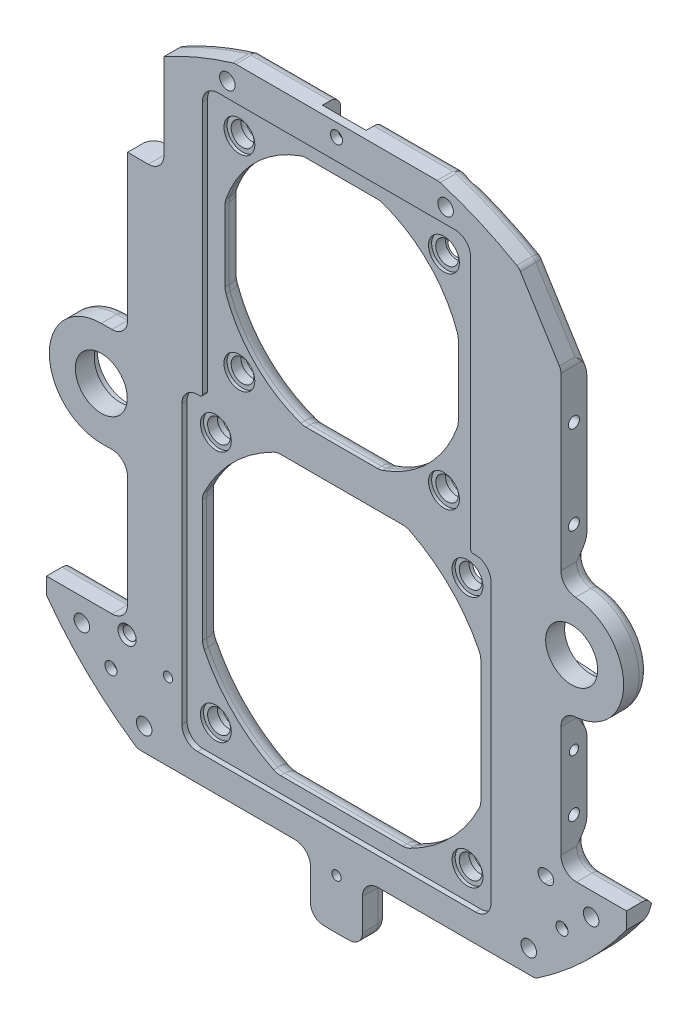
SolidWorks part; units mm, degrees
ref_plane "Front Plane" through (0, 0, 0) normal (0, 0, 1) x (1, 0, 0)
ref_plane "Top Plane" through (0, 0, 0) normal (0, 1, 0) x (1, 0, 0)
ref_plane "Right Plane" through (0, 0, 0) normal (1, 0, 0) x (0, 0, -1)
sketch "Sketch1" plane through (0, 0, 0) normal (0, 0, 1) x (1, 0, 0)
  line L2 (-51.054, 52.1208) -> (-45.974, 52.1208)
  line L3 (-42.164, 55.9308) -> (-42.164, 76.8194)
  line L4 (87.63, 0) -> (-87.63, 0) construction
  line L5 (0, 87.63) -> (0, -87.63) construction
  line L11 (-51.054, -43.6754) -> (-51.054, -16.51)
  line L12 (-51.054, 16.51) -> (-51.054, 52.1208)
  line L14 (54.4653, 59.6481) -> (44.9354, 74.8991)
  line L15 (6.35, -76.708) -> (6.35, -84.3953)
  line L17 (-6.35, -76.708) -> (-6.35, -84.3953)
  line L18 (54.8513, -16.5185) -> (54.8513, -43.6754)
  line L21 (47.8532, -72.898) -> (10.16, -72.898)
  line L22 (70.866, -47.4854) -> (58.6613, -47.4854)
  line L23 (54.8513, 16.5185) -> (54.8513, 58.3021)
  line L25 (-54.864, -12.7) -> (-57.4802, -12.7)
  line L26 (-54.864, 12.7) -> (-57.4802, 12.7)
  line L28 (-54.864, -47.4854) -> (-70.866, -47.4854)
  line L30 (24.6055, 83.9947) -> (-24.6055, 83.9947)
  line L31 (-10.16, -72.898) -> (-47.8532, -72.898)
  line L32 (70.866, -47.4854) -> (70.866, -51.5451)
  line L33 (-70.866, -47.4854) -> (-70.866, -51.5451)
  arc A1 (-45.974, 52.1208) -> (-42.164, 55.9308) centre (-45.974, 55.9308) ccw
  arc A3 (58.4276, -12.6646) -> (58.4276, 12.6646) centre (57.4802, 0) ccw
  arc A4 (-57.4802, 12.7) -> (-57.4802, -12.7) centre (-57.4802, 0) ccw
  arc A7 (70.866, -51.5451) -> (49.2817, -72.4583) centre (0, 0) cw
  arc A8 (44.0584, 75.7487) -> (25.34, 83.8862) centre (0, 0) ccw
  arc A10 (-51.054, 16.51) -> (-54.864, 12.7) centre (-54.864, 16.51) cw
  arc A11 (-51.054, -16.51) -> (-54.864, -12.7) centre (-54.864, -16.51) ccw
  arc A14 (-49.2817, -72.4583) -> (-70.866, -51.5451) centre (0, 0) cw
  arc A15 (-51.054, -43.6754) -> (-54.864, -47.4854) centre (-54.864, -43.6754) cw
  arc A16 (54.8513, -43.6754) -> (58.6613, -47.4854) centre (58.6613, -43.6754) ccw
  arc A18 (54.8513, 16.5185) -> (58.4276, 12.6646) centre (58.7159, 16.5185) ccw
  arc A19 (54.8513, -16.5185) -> (58.4276, -12.6646) centre (58.7159, -16.5185) cw
  arc A20 (-25.34, 83.8862) -> (-42.164, 76.8194) centre (0, 0) ccw
  arc A22 (3.2944, -87.5681) -> (-3.2944, -87.5681) centre (0, 0) cw
  arc A23 (6.35, -76.708) -> (10.16, -72.898) centre (10.16, -76.708) cw
  arc A24 (-10.16, -72.898) -> (-6.35, -76.708) centre (-10.16, -76.708) cw
  arc A25 (6.35, -84.3953) -> (3.2944, -87.5681) centre (3.175, -84.3953) cw
  arc A26 (-6.35, -84.3953) -> (-3.2944, -87.5681) centre (-3.175, -84.3953) ccw
  arc A27 (-47.8532, -72.898) -> (-49.2817, -72.4583) centre (-47.8532, -70.358) cw
  arc A28 (47.8532, -72.898) -> (49.2817, -72.4583) centre (47.8532, -70.358) ccw
  arc A29 (-25.34, 83.8862) -> (-24.6055, 83.9947) centre (-24.6055, 81.4547) cw
  arc A30 (25.34, 83.8862) -> (24.6055, 83.9947) centre (24.6055, 81.4547) ccw
  arc A31 (44.9354, 74.8991) -> (44.0584, 75.7487) centre (42.7814, 73.5531) ccw
  arc A32 (54.4653, 59.6481) -> (54.8513, 58.3021) centre (52.3113, 58.3021) cw
  point P11 (-70.866, -49.5153)
  point P37 (-51.054, -47.4854)
  point P40 (54.8513, -47.4854)
  point P47 (6.35, -72.898)
  point P51 (-6.35, -72.898)
  point P67 (-51.054, 12.7)
  point P70 (-51.054, -12.7)
  point P72 (54.8513, 59.0304)
  dimension "D1" = 42.164
  dimension "D3" = 3.81
  dimension "D5" = 87.63
  dimension "D7" = 54.8513
  dimension "D9" = 87.6293
  dimension "D10" = 12.7
  dimension "D11" = 12.7
  dimension "D4" = 3.81
  dimension "D16" = 3.81
  dimension "D19" = 3.8646
  dimension "D17" = 87.63
  dimension "D21" = 87.63
  dimension "D22" = 3.81
  dimension "D23" = 3.175
  dimension "D25" = 2.54
  dimension "D2" = 52.1208
  dimension "D6" = 83.9947
  dimension "D8" = 72.898
  dimension "D12" = 212
  dimension "D13" = 59.0304
  dimension "D14" = 51.054
  dimension "D15" = 47.4854
  dimension "D18" = 57.4802
  dimension "D20" = 6.35
  dimension "D24" = 10.16
  dimension "D26" = 70.866
extrude "Boss-Extrude1" add sketch "Sketch1" along normal blind 6.35
hole_wizard "1/2 (0.5) Diameter Hole1" positions "Sketch8" profile "Sketch9" hole size "1/2" standard "ANSI Inch"
sketch "Sketch8" plane through (0, 0, 6.35) normal (0, 0, 1) x (1, 0, 0)
  line L0 (0, 0) -> (80.7636, 0) construction
  line L2 (0, 0) -> (0, 45.4326) construction
  line L4 (0, 0) -> (-84.3163, 0) construction
  point P0 (-57.4802, 0)
  point P3 (57.4802, 0)
  dimension "D1" = 57.4802
  dimension "D2" = 57.4802
sketch "Sketch9" plane through (-57.4802, 0, 6.35) normal (1, 0, 0) x (0, -1, 0)
  line L0 (0, 0) -> (0, 6.35)
  line L1 (0, 6.35) -> (6.35, 6.35)
  line L2 (6.35, 6.35) -> (6.35, 0)
  line L5 (6.35, 0) -> (0, 0)
  line L11 (0, -6.35) -> (0, 107.95) construction
  dimension "Thru Hole Dia." = 12.7
  dimension "Thru Hole Depth" = 6.35
hole_wizard "#4-40 Tapped Hole1" positions "Sketch11" profile "Sketch12" tap size "#4-40" standard "ANSI Inch"
sketch "Sketch11" plane through (54.8513, 0, 0) normal (1, 0, 0) x (0, 0, -1)
  line L0 (0, 0) -> (0, -92.8923) construction
  line L2 (0, 0) -> (53.8464, 0) construction
  point P0 (-3.175, -23.0347)
  dimension "D1" = 3.175
  dimension "D2" = 23.0347
sketch "Sketch12" plane through (54.8513, -23.0347, 3.175) normal (0, 1, 0) x (0, 0, -1)
  line L0 (0, 0) -> (0, 8.2738)
  line L1 (0, 8.2738) -> (1.1303, 7.5946)
  line L2 (1.1303, 7.5946) -> (1.1303, 0)
  line L5 (1.1303, 0) -> (0, 0)
  line L10 (0, 8.2738) -> (-1.1303, 7.5946) construction
  line L11 (0, -6.35) -> (0, 107.95) construction
  dimension "Tap Drill Dia." = 2.2606
  dimension "Tap Drill Depth" = 7.5946
  dimension "Drill Angle" = 118
hole_wizard "#6-32 Tapped Hole1" positions "Sketch13" profile "Sketch14" tap size "#6-32" standard "ANSI Inch"
sketch "Sketch13" plane through (54.8513, 0, 0) normal (1, 0, 0) x (0, 0, -1)
  line L0 (-3.175, 46.3304) -> (-3.175, -36.7157) construction
  line L2 (-30.0077, 0) -> (44.6628, 0) construction
  point P0 (-3.175, 46.3304)
  point P3 (-3.175, 24.765)
  point P6 (-3.175, -36.7157)
  dimension "D1" = 3.175
  dimension "D2" = 24.765
  dimension "D3" = 46.3304
  dimension "D4" = 36.7157
sketch "Sketch14" plane through (54.8513, 46.3304, 3.175) normal (0, 1, 0) x (0, 0, -1)
  line L0 (0, 0) -> (0, 10.2107)
  line L1 (0, 10.2107) -> (1.3525, 9.398)
  line L2 (1.3525, 9.398) -> (1.3525, 0)
  line L5 (1.3525, 0) -> (0, 0)
  line L10 (0, 10.2107) -> (-1.3525, 9.398) construction
  line L11 (0, -6.35) -> (0, 107.95) construction
  dimension "Tap Drill Dia." = 2.7051
  dimension "Tap Drill Depth" = 9.398
  dimension "Drill Angle" = 118
hole_wizard "#6-32 Tapped Hole2" positions "Sketch15" profile "Sketch16" tap size "#6-32" standard "ANSI Inch"
sketch "Sketch15" plane through (-42.164, 0, 0) normal (-1, 0, 0) x (0, 0, 1)
  point P0 (3.1755, 70.1627)
sketch "Sketch16" plane through (-42.164, 70.1627, 3.1755) normal (0, 1, 0) x (0, 0, 1)
  line L0 (0, 0) -> (0, 10.2107)
  line L1 (0, 10.2107) -> (1.3525, 9.398)
  line L2 (1.3525, 9.398) -> (1.3525, 0)
  line L5 (1.3525, 0) -> (0, 0)
  line L10 (0, 10.2107) -> (-1.3525, 9.398) construction
  line L11 (0, -6.35) -> (0, 107.95) construction
  dimension "Tap Drill Dia." = 2.7051
  dimension "Tap Drill Depth" = 9.398
  dimension "Drill Angle" = 118
hole_wizard "Ø3.0mm Dowel Hole1" positions "Sketch17" profile "Sketch18" hole size "Ø3.0" standard "ANSI Metric"
sketch "Sketch17" plane through (-42.164, 0, 0) normal (-1, 0, 0) x (0, 0, 1)
  point P0 (3.175, 62.7967)
sketch "Sketch18" plane through (-42.164, 62.7967, 3.175) normal (0, 1, 0) x (0, 0, 1)
  line L0 (0, 0) -> (0, 8.8769)
  line L1 (0, 8.8769) -> (1.5, 7.9756)
  line L2 (1.5, 7.9756) -> (1.5, 0.25)
  line L3 (1.5, 0.25) -> (1.75, 0)
  line L5 (1.75, 0) -> (0, 0)
  line L6 (-1.5, 0.25) -> (-1.75, 0) construction
  line L10 (0, 8.8769) -> (-1.5, 7.9756) construction
  line L11 (0, -6.35) -> (0, 107.95) construction
  dimension "Hole Dia." = 3
  dimension "Hole Depth" = 7.9756
  dimension "Near C'Sink Dia." = 3.5
  dimension "Near C'Sink Angle" = 90
  dimension "Drill Angle" = 118
sketch "Sketch19" plane through (0, 0, 6.35) normal (0, 0, 1) x (1, 0, 0)
  line L0 (0, 89.6063) -> (0, -81.1352) construction
  line L1 (-74.2978, 0) -> (77.4725, 0) construction
  line L2 (-55.5397, 42.9643) -> (62.1249, 42.9643) construction
  line L3 (-55.5397, -28.3857) -> (62.1249, -28.3857) construction
  line L4 (-33.9683, 9.3923) -> (-33.413, 9.3923)
  line L5 (-37.7783, 5.5823) -> (-37.7783, -62.3537)
  line L6 (-33.9683, -66.1637) -> (33.968, -66.1637)
  line L7 (37.778, 5.5823) -> (37.778, -62.3537)
  line L8 (-37.7783, 9.3923) -> (37.778, -66.1637) construction
  line L9 (-37.7783, -66.1637) -> (37.778, 9.3923) construction
  line L10 (-28.968, 75.7423) -> (28.968, 75.7423)
  line L11 (-32.778, 71.9323) -> (-32.778, 10.0273)
  line L13 (32.778, 71.9323) -> (32.778, 10.0273)
  line L14 (-32.778, 75.7423) -> (32.778, 10.1863) construction
  line L15 (-32.778, 10.1863) -> (32.778, 75.7423) construction
  line L16 (33.413, 9.3923) -> (33.968, 9.3923)
  arc A0 (33.968, -66.1637) -> (37.778, -62.3537) centre (33.968, -62.3537) ccw
  arc A1 (-37.7783, -62.3537) -> (-33.9683, -66.1637) centre (-33.9683, -62.3537) ccw
  arc A2 (33.968, 9.3923) -> (37.778, 5.5823) centre (33.968, 5.5823) cw
  arc A3 (-33.9683, 9.3923) -> (-37.7783, 5.5823) centre (-33.9683, 5.5823) ccw
  arc A6 (28.968, 75.7423) -> (32.778, 71.9323) centre (28.968, 71.9323) cw
  arc A7 (-28.968, 75.7423) -> (-32.778, 71.9323) centre (-28.968, 71.9323) ccw
  arc A8 (32.778, 10.0273) -> (33.413, 9.3923) centre (33.413, 10.0273) ccw
  arc A9 (-32.778, 10.0273) -> (-33.413, 9.3923) centre (-33.413, 10.0273) cw
  point P8 (-0.0002, -28.3857)
  point P13 (0, 42.9643)
  point P42 (32.778, 9.3923)
  dimension "D5" = 3.81
  dimension "D8" = 0.635
  dimension "D1" = 37.778
  dimension "D2" = 37.778
  dimension "D3" = 32.778
  dimension "D4" = 32.778
  dimension "D6" = 42.9643
  dimension "D7" = 28.3857
  dimension "D9" = 75.556
  dimension "D10" = 75.5563
  dimension "D11" = 65.556
extrude "Cut-Extrude1" cut sketch "Sketch19" against normal blind 1.27
sketch "Sketch20" plane through (0, 0, 5.08) normal (0, 0, 1) x (1, 0, 0)
  line L0 (0, -75.537) -> (0, 94.5479) construction
  line L1 (-75.6346, 0) -> (77.6486, 0) construction
  line L2 (-56.8486, 42.9643) -> (60.7684, 42.9643) construction
  line L3 (-54.126, -28.3857) -> (67.8472, -28.3857) construction
  line L4 (14.9526, -62.3857) -> (-14.9526, -62.3857)
  line L5 (-34.0002, -43.338) -> (-34.0002, -13.4334)
  line L6 (-14.9526, 5.6143) -> (14.9526, 5.6143)
  line L7 (33.9998, -13.4328) -> (33.9998, -43.3386)
  line L8 (-8.7361, 71.4643) -> (8.7361, 71.4643)
  line L9 (-28.5, 51.7004) -> (-28.5, 34.2282)
  line L10 (-8.7361, 14.4643) -> (8.7361, 14.4643)
  line L11 (28.5, 51.7004) -> (28.5, 34.2282)
  line L12 (37.778, -62.3537) -> (37.778, 5.5823) construction
  line L13 (-33.413, 9.3923) -> (-33.9683, 9.3923) construction
  arc A0 (-16.6436, 5.2185) -> (-33.6044, -11.7425) centre (0, -28.3857) ccw
  arc A1 (33.604, -11.7418) -> (16.6436, 5.2185) centre (0, -28.3857) ccw
  arc A2 (16.6436, -61.9899) -> (33.604, -45.0296) centre (0, -28.3857) ccw
  arc A3 (-33.6044, -45.0289) -> (-16.6436, -61.9899) centre (0, -28.3857) ccw
  arc A4 (-28.2818, 32.9573) -> (-10.007, 14.6825) centre (0, 42.9643) ccw
  arc A5 (10.007, 14.6825) -> (28.2818, 32.9573) centre (0, 42.9643) ccw
  arc A6 (28.2818, 52.9713) -> (10.007, 71.2461) centre (0, 42.9643) ccw
  arc A7 (-10.007, 71.2461) -> (-28.2818, 52.9713) centre (0, 42.9643) ccw
  arc A8 (33.9998, -13.4328) -> (33.604, -11.7418) centre (30.1898, -13.4328) ccw
  arc A9 (33.9998, -43.3386) -> (33.604, -45.0296) centre (30.1898, -43.3386) cw
  arc A10 (14.9526, -62.3857) -> (16.6436, -61.9899) centre (14.9526, -58.5757) ccw
  arc A11 (-33.6044, -45.0289) -> (-34.0002, -43.338) centre (-30.1902, -43.338) cw
  arc A12 (-34.0002, -13.4334) -> (-33.6044, -11.7425) centre (-30.1902, -13.4334) cw
  arc A13 (-14.9526, 5.6143) -> (-16.6436, 5.2185) centre (-14.9526, 1.8043) ccw
  arc A14 (14.9526, 5.6143) -> (16.6436, 5.2185) centre (14.9526, 1.8043) cw
  arc A15 (28.5, 34.2282) -> (28.2818, 32.9573) centre (24.69, 34.2282) cw
  arc A16 (-8.7361, 14.4643) -> (-10.007, 14.6825) centre (-8.7361, 18.2743) cw
  arc A17 (-28.5, 34.2282) -> (-28.2818, 32.9573) centre (-24.69, 34.2282) ccw
  arc A18 (-28.5, 51.7004) -> (-28.2818, 52.9713) centre (-24.69, 51.7004) cw
  arc A19 (-8.7361, 71.4643) -> (-10.007, 71.2461) centre (-8.7361, 67.6543) ccw
  arc A20 (8.7361, 71.4643) -> (10.007, 71.2461) centre (8.7361, 67.6543) cw
  arc A21 (28.5, 51.7004) -> (28.2818, 52.9713) centre (24.69, 51.7004) ccw
  arc A22 (-14.9526, -62.3857) -> (-16.6436, -61.9899) centre (-14.9526, -58.5757) cw
  arc A23 (8.7361, 14.4643) -> (10.007, 14.6825) centre (8.7361, 18.2743) ccw
  point P9 (0, 42.9643)
  point P21 (-0.0002, -28.3857)
  point P40 (15.8193, -62.3857)
  point P59 (-9.3675, 71.4643)
  dimension "D2" = 37.5
  dimension "D7" = 30
  dimension "D13" = 3.81
  dimension "D14" = 3.81
  dimension "D1" = 34
  dimension "D3" = 28.5
  dimension "D4" = 28.5
  dimension "D5" = 28.5
  dimension "D6" = 57
  dimension "D8" = 28.3857
  dimension "D9" = 42.9643
  dimension "D10" = 34.0002
  dimension "D11" = 68
  dimension "D12" = 68
extrude "Cut-Extrude2" cut sketch "Sketch20" against normal through all
hole_wizard "CBORE for #6 Button Head Cap Screw1" positions "Sketch23" profile "Sketch24" counterbore size "#6" standard "ANSI Inch"
sketch "Sketch23" plane through (0, 0, 0) normal (0, 0, -1) x (-1, 0, 0)
  line L0 (0, 83.4578) -> (0, -83.4578) construction
  line L2 (-79.5524, 0) -> (79.5524, 0) construction
  line L5 (-25, 67.9643) -> (25, 67.9643) construction
  line L6 (25, 67.9643) -> (25, 17.9643) construction
  line L7 (25, 17.9643) -> (-25, 17.9643) construction
  line L8 (-25, 17.9643) -> (-25, 67.9643) construction
  line L10 (30.75, 2.364) -> (-30.75, 2.364) construction
  line L11 (-30.75, 2.364) -> (-30.75, -59.136) construction
  line L12 (-30.75, -59.136) -> (30.75, -59.136) construction
  line L13 (30.75, -59.136) -> (30.75, 2.364) construction
  point P0 (-25, 67.9643)
  point P2 (25, 67.9643)
  point P4 (25, 17.9643)
  point P6 (-25, 17.9643)
  point P22 (0, 0)
  point P41 (0, 0)
  point P76 (30.75, 2.364)
  point P79 (-30.75, 2.364)
  point P82 (30.75, -59.136)
  point P85 (-30.75, -59.136)
  dimension "D1" = 17.9643
  dimension "D2" = 50
  dimension "D3" = 25
  dimension "D4" = 50
  dimension "D5" = 2.364
  dimension "D6" = 61.5
  dimension "D7" = 30.75
  dimension "D8" = 61.5
sketch "Sketch24" plane through (25, 67.9643, 0) normal (1, 0, 0) x (0, 1, 0)
  line L0 (0, 0) -> (0, 6.35)
  line L1 (0, 6.35) -> (2.7775, 6.35)
  line L3 (2.7775, 6.35) -> (2.7775, 1.9304)
  line L4 (2.7775, 1.9304) -> (3.7706, 1.9304)
  line L5 (3.7706, 1.9304) -> (3.7706, 0)
  line L7 (3.7706, 0) -> (0, 0)
  line L11 (0, -6.35) -> (0, 107.95) construction
  dimension "Thru Hole Dia." = 5.555
  dimension "Thru Hole Depth" = 6.35
  dimension "C'Bore Dia." = 7.5413
  dimension "C'Bore Depth" = 1.9304
fillet "Fillet1" radius 4.064 32 edges at (26.5164, -1.8691, 0) (33.9998, -28.3857, 0) (26.5164, -54.9023, 0) (0, -62.3857, 0) (-26.5166, -54.9021, 0) (-34.0002, -28.3857, 0) (-26.5166, -1.8693, 0) (0, 5.6143, 0) (21.2132, 64.1775, 0) (28.5, 42.9643, 0) (21.2132, 21.7511, 0) (0, 14.4643, 0) (-21.2132, 21.7511, 0) (-28.5, 42.9643, 0) (-21.2132, 64.1775, 0) (0, 71.4643, 0) (15.8209, 5.514, 0) (33.8996, -12.5644, 0) (33.8996, -44.207, 0) (15.8209, -62.2854, 0) (-15.8209, -62.2854, 0) (-33.8999, -44.2063, 0) (-33.8999, -12.5651, 0) (-15.8209, 5.514, 0) (9.3809, 71.4094, 0) (28.4451, 52.3452, 0) (28.4451, 33.5834, 0) (9.3809, 14.5192, 0) (-9.3809, 14.5192, 0) (-28.4451, 33.5834, 0) (-28.4451, 52.3452, 0) (-9.3809, 71.4094, 0)
sketch "Sketch26" plane through (0, 0, 5.08) normal (0, 0, 1) x (1, 0, 0)
  line L0 (0, 80.0394) -> (0, -80.0394) construction
  line L1 (80.8716, 0) -> (-80.8716, 0) construction
  line L2 (-30.75, 2.364) -> (30.75, 2.364) construction
  line L3 (30.75, 2.364) -> (30.75, -59.136) construction
  line L4 (30.75, -59.136) -> (-30.75, -59.136) construction
  line L5 (-30.75, -59.136) -> (-30.75, 2.364) construction
  line L6 (-25, 67.9643) -> (25, 67.9643) construction
  line L7 (25, 67.9643) -> (25, 17.9643) construction
  line L8 (25, 17.9643) -> (-25, 17.9643) construction
  line L9 (-25, 17.9643) -> (-25, 67.9643) construction
  circle A0 centre (-25, 67.9643) radius 3.7706
  circle A1 centre (25, 67.9643) radius 3.7706
  circle A2 centre (-25, 17.9643) radius 3.7706
  circle A3 centre (25, 17.9643) radius 3.7706
  circle A8 centre (30.75, -59.136) radius 3.7706
  circle A9 centre (30.75, 2.364) radius 3.7706
  circle A10 centre (-30.75, 2.364) radius 3.7706
  circle A11 centre (-30.75, -59.136) radius 3.7706
  dimension "D1" = 7.5413
  dimension "D2" = 7.5413
  dimension "D3" = 2.364
  dimension "D4" = 61.5
  dimension "D5" = 30.75
  dimension "D6" = 61.5
extrude "Cut-Extrude3" cut sketch "Sketch26" against normal blind 0.762
hole_wizard "CBORE for #6 Socket Head Cap Screw2" positions "Sketch27" profile "Sketch28" counterbore size "#6" standard "ANSI Inch"
sketch "Sketch27" plane through (0, 0, 0) normal (0, 0, -1) x (-1, 0, 0)
  line L4 (-26.67, 79.375) -> (0, 79.375) construction
  line L5 (-98.305, 0) -> (98.305, 0) construction
  line L7 (0, 87.0249) -> (0, -87.0249) construction
  point P0 (-26.67, 79.375)
  point P169 (26.67, 79.375)
  dimension "D1" = 26.67
  dimension "D2" = 79.375
sketch "Sketch28" plane through (26.67, 79.375, 0) normal (1, 0, 0) x (0, 1, 0)
  line L0 (0, 0) -> (0, 6.35)
  line L1 (0, 6.35) -> (1.8986, 6.35)
  line L3 (1.8986, 6.35) -> (1.8986, 3.5052)
  line L4 (1.8986, 3.5052) -> (3.5725, 3.5052)
  line L5 (3.5725, 3.5052) -> (3.5725, 0)
  line L7 (3.5725, 0) -> (0, 0)
  line L11 (0, -6.35) -> (0, 107.95) construction
  dimension "Thru Hole Dia." = 3.7973
  dimension "Thru Hole Depth" = 6.35
  dimension "C'Bore Dia." = 7.145
  dimension "C'Bore Depth" = 3.5052
hole_wizard "CBORE for #6 Socket Head Cap Screw1" positions "Sketch30" profile "Sketch31" counterbore size "#6" standard "ANSI Inch"
sketch "Sketch30" plane through (0, 0, 0) normal (0, 0, -1) x (-1, 0, 0)
  line L9 (-93.0521, 0) -> (93.0521, 0) construction
  line L11 (0, 84.0767) -> (0, -84.0767) construction
  point P51 (-62.23, -53.086)
  point P53 (-46.99, -67.31)
  point P76 (0, 0)
  point P87 (0, 0)
  point P90 (46.99, -67.31)
  point P91 (62.23, -53.086)
  dimension "D1" = 53.086
  dimension "D2" = 67.31
  dimension "D3" = 62.23
  dimension "D4" = 46.99
sketch "Sketch31" plane through (62.23, -53.086, 0) normal (1, 0, 0) x (0, 1, 0)
  line L0 (0, 0) -> (0, 6.35)
  line L1 (0, 6.35) -> (1.8986, 6.35)
  line L3 (1.8986, 6.35) -> (1.8986, 3.5052)
  line L4 (1.8986, 3.5052) -> (3.5725, 3.5052)
  line L5 (3.5725, 3.5052) -> (3.5725, 0)
  line L7 (3.5725, 0) -> (0, 0)
  line L11 (0, -6.35) -> (0, 107.95) construction
  dimension "Thru Hole Dia." = 3.7973
  dimension "Thru Hole Depth" = 6.35
  dimension "C'Bore Dia." = 7.145
  dimension "C'Bore Depth" = 3.5052
fillet "Fillet2" radius 2.54 22 edges at (60.9771, -62.9339, 0) (29.0066, -72.898, 0) (-60.9771, -62.9339, 0) (-33.9365, 80.7919, 0) (49.7004, 67.2736, 0) (34.937, 80.3643, 0) (0, 83.9947, 0) (-51.054, 34.3154, 0) (-52.1699, 13.8159, 0) (-56.1721, 12.7, 0) (-70.1802, 0, 0) (-56.1721, -12.7, 0) (-52.1699, -13.8159, 0) (-62.865, -47.4854, 0) (-52.1699, -46.3695, 0) (-51.054, -30.0927, 0) (55.8831, 13.8897, 0) (70.1802, 0, 0) (55.8831, -13.8897, 0) (55.9672, -46.3695, 0) (64.7636, -47.4854, 0) (-29.0066, -72.898, 0)
hole_wizard "#4-40 Tapped Hole2" positions "Sketch32" profile "Sketch33" tap size "#4-40" standard "ANSI Inch"
sketch "Sketch32" plane through (0, 0, 6.35) normal (0, 0, 1) x (1, 0, 0)
  line L0 (0, 0) -> (0, -102.7005) construction
  line L2 (0, 0) -> (-87.6382, 0) construction
  point P0 (0, -75.438)
  dimension "D1" = 75.438
sketch "Sketch33" plane through (0, -75.438, 6.35) normal (1, 0, 0) x (0, -1, 0)
  line L0 (0, 0) -> (0, 8.2738)
  line L1 (0, 8.2738) -> (1.1303, 7.5946)
  line L2 (1.1303, 7.5946) -> (1.1303, 0)
  line L5 (1.1303, 0) -> (0, 0)
  line L10 (0, 8.2738) -> (-1.1303, 7.5946) construction
  line L11 (0, -6.35) -> (0, 107.95) construction
  dimension "Tap Drill Dia." = 2.2606
  dimension "Tap Drill Depth" = 7.5946
  dimension "Drill Angle" = 118
hole_wizard "1/8 (0.125) Diameter Hole1" positions "Sketch37" profile "Sketch38" hole size "1/8" standard "ANSI Inch"
sketch "Sketch37" plane through (0, 0, 0) normal (0, 0, -1) x (-1, 0, 0)
  line L0 (0, 0) -> (0, -104.877) construction
  line L2 (89.9651, 0) -> (0, 0) construction
  line L4 (-8.0993, -50.0507) -> (51.181, -50.0507) construction
  point P3 (51.181, -50.0507)
  point P16 (0, 0)
  dimension "D1" = 50.0507
  dimension "D3" = 51.181
sketch "Sketch38" plane through (-51.181, -50.0507, 0) normal (1, 0, 0) x (0, 1, 0)
  line L0 (0, 0) -> (0, 6.35)
  line L1 (0, 6.35) -> (2.2225, 6.35)
  line L2 (1.5875, 5.715) -> (1.5875, 0)
  line L5 (1.5875, 0) -> (0, 0)
  line L7 (2.2225, 6.35) -> (1.5875, 5.715)
  line L8 (-2.2225, 6.35) -> (-1.5875, 5.715) construction
  line L11 (0, -6.35) -> (0, 107.95) construction
  dimension "Thru Hole Dia." = 3.175
  dimension "Thru Hole Depth" = 6.35
  dimension "Far C'Sink Dia." = 4.445
  dimension "Far C'Sink Angle" = 90
sketch "Sketch40" plane through (0, 0, 0) normal (0, 0, -1) x (-1, 0, 0)
  line L0 (0, 93.6589) -> (0, -105.1281) construction
  line L1 (-112.8529, 0) -> (133.4275, 0) construction
  line L2 (0, 0) -> (-73.7044, -79.0383) construction
  line L3 (-64.5307, -61.3796) -> (-56.5103, -52.7787)
  line L4 (-51.8434, -52.6157) -> (-48.8711, -55.3874)
  line L5 (-48.7082, -60.0543) -> (-56.7286, -68.6551)
  line L6 (-56.7286, -68.6551) -> (-64.5307, -61.3796)
  line L7 (0, 0) -> (73.7044, -79.0383) construction
  line L8 (56.7286, -68.6551) -> (64.5307, -61.3796)
  line L9 (48.7082, -60.0543) -> (56.7286, -68.6551)
  line L10 (51.8434, -52.6157) -> (48.8711, -55.3874)
  line L11 (64.5307, -61.3796) -> (56.5103, -52.7787)
  line L12 (5.334, 88.9) -> (5.334, 77.1398)
  line L13 (-5.334, 88.9) -> (5.334, 88.9)
  line L14 (-5.334, 77.1398) -> (-5.334, 88.9)
  line L15 (2.032, 73.8378) -> (-2.032, 73.8378)
  arc A0 (-48.8711, -55.3874) -> (-48.7082, -60.0543) centre (-51.1231, -57.8023) cw
  arc A1 (-56.5103, -52.7787) -> (-51.8434, -52.6157) centre (-54.0953, -55.0307) cw
  arc A2 (56.5103, -52.7787) -> (51.8434, -52.6157) centre (54.0953, -55.0307) ccw
  arc A3 (48.8711, -55.3874) -> (48.7082, -60.0543) centre (51.1231, -57.8023) ccw
  arc A4 (5.334, 77.1398) -> (2.032, 73.8378) centre (2.032, 77.1398) cw
  arc A5 (-2.032, 73.8378) -> (-5.334, 77.1398) centre (-2.032, 77.1398) cw
  dimension "D5" = 3.302
  dimension "D1" = 47
  dimension "D2" = 5.334
  dimension "D3" = 5.334
  dimension "D4" = 73.8378
  dimension "D6" = 88.9
  dimension "D7" = 2
extrude "Cut-Extrude5" cut sketch "Sketch40" against normal blind 4.445
hole_wizard "#4 Clearance Hole1" positions "Sketch41" profile "Sketch42" hole size "#4" standard "ANSI Inch"
sketch "Sketch41" plane through (0, 0, 4.445) normal (0, 0, -1) x (-1, 0, 0)
  line L0 (0, 0) -> (-76.8267, -82.3865) construction
  line L2 (0, 0) -> (0, -102.6583) construction
  line L4 (0, 0) -> (-95.6715, 0) construction
  line L5 (0, 0) -> (0, 91.7474) construction
  point P0 (-55.121, -59.1101)
  point P16 (55.121, -59.1101)
  point P26 (0, 80.8228)
  point P27 (0, 0)
  dimension "D1" = 47
  dimension "D2" = 80.8228
  dimension "D4" = 80.8228
  dimension "D3" = 2
sketch "Sketch42" plane through (55.121, -59.1101, 4.445) normal (1, 0, 0) x (0, 1, 0)
  line L0 (0, 0) -> (0, 1.905)
  line L1 (0, 1.905) -> (1.4732, 1.905)
  line L2 (1.4732, 1.905) -> (1.4732, 0)
  line L5 (1.4732, 0) -> (0, 0)
  line L11 (0, -6.35) -> (0, 107.95) construction
  dimension "Thru Hole Dia." = 2.9464
  dimension "Thru Hole Depth" = 1.905
hole_wizard "#4-40 Tapped Hole3" positions "Sketch43" profile "Sketch44" tap size "#4-40" standard "ANSI Inch"
sketch "Sketch43" plane through (0, 0, 0) normal (0, 0, -1) x (-1, 0, 0)
  point P0 (41.1736, -53.987)
sketch "Sketch44" plane through (-41.1736, -53.987, 0) normal (1, 0, 0) x (0, 1, 0)
  line L0 (0, 0) -> (0, 8.2738)
  line L1 (0, 8.2738) -> (1.1303, 7.5946)
  line L2 (1.1303, 7.5946) -> (1.1303, 0)
  line L5 (1.1303, 0) -> (0, 0)
  line L10 (0, 8.2738) -> (-1.1303, 7.5946) construction
  line L11 (0, -6.35) -> (0, 107.95) construction
  dimension "Tap Drill Dia." = 2.2606
  dimension "Tap Drill Depth" = 7.5946
  dimension "Drill Angle" = 118
sketch "Sketch45" plane through (0, 0, 0) normal (0, 0, -1) x (-1, 0, 0)
  circle A0 centre (-43.815, 0) radius 6.35
  circle A1 centre (43.815, 0) radius 6.35
extrude "Cut-Extrude6" cut sketch "Sketch45" against normal blind 2.54
hole_wizard "1/8 (0.125) Diameter Slot1" positions "Sketch46" profile "Sketch47" size "1/8" standard "ANSI Inch"
sketch "Sketch46" plane through (0, 0, 0) normal (0, 0, -1) x (-1, 0, 0)
  line L0 (-49.276, -50.0507) -> (-53.086, -50.0507) construction
  line L1 (0, 0) -> (0, -99.2466) construction
  line L6 (0, 0) -> (-89.2589, 0) construction
  point P0 (-51.181, -50.0507)
  dimension "D1" = 3.81
  dimension "D2" = 51.181
  dimension "D3" = 50.0507
sketch "Sketch47" plane through (51.181, -50.0507, 0) normal (1, 0, 0) x (0, 1, 0)
  line L0 (0, 0) -> (0, 6.35)
  line L1 (0, 6.35) -> (1.5875, 6.35)
  line L2 (1.5875, 6.35) -> (1.5875, 0)
  line L5 (1.5875, 0) -> (0, 0)
  line L11 (0, -6.35) -> (0, 107.95) construction
  dimension "Thru Hole Dia." = 3.175
  dimension "Thru Hole Depth" = 6.35
sketch "Sketch48" plane through (0, 0, 0) normal (0, 0, -1) x (-1, 0, 0)
  line L0 (43.3665, 6.3341) -> (56.9635, 7.2969)
  line L1 (56.9635, -7.2969) -> (43.3665, -6.3341)
  line L2 (43.815, 0) -> (57.4802, 0) construction
  circle A0 centre (43.815, 0) radius 6.35 construction
  arc A1 (56.9635, 7.2969) -> (56.9635, -7.2969) centre (57.4802, 0) cw
  arc A2 (43.3665, -6.3341) -> (43.3665, 6.3341) centre (43.815, 0) cw
  point P8 (0, 0)
  dimension "D1" = 7.3152
extrude "Cut-Extrude7" cut sketch "Sketch48" against normal blind 1.7272
mirror "Mirror1" about plane through (0, 0, 0) normal (1, 0, 0) of "Cut-Extrude7"
